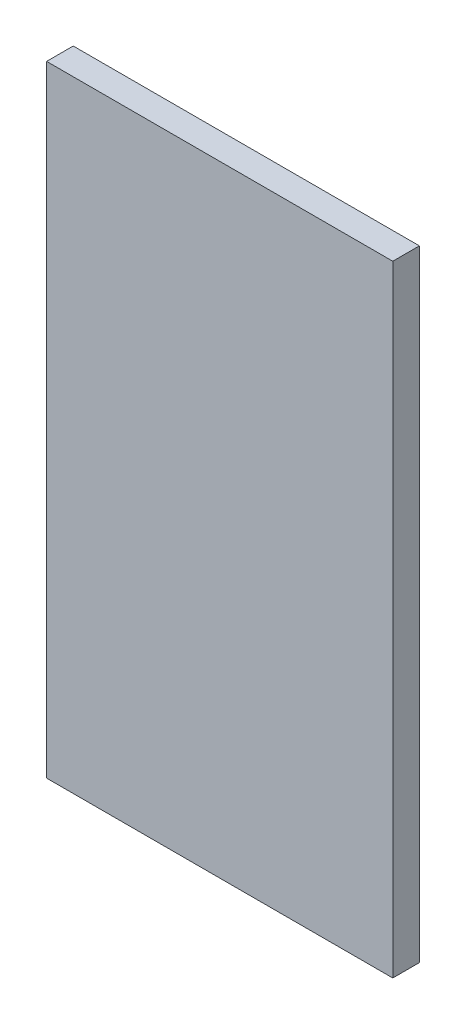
SolidWorks part; units mm, degrees
ref_plane "Спереди" through (0, 0, 0) normal (0, 0, 1) x (1, 0, 0)
ref_plane "Сверху" through (0, 0, 0) normal (0, 1, 0) x (1, 0, 0)
ref_plane "Справа" through (0, 0, 0) normal (1, 0, 0) x (0, 0, -1)
sketch "Эскиз1" plane through (0, 0, 0) normal (0, 0, 1) x (1, 0, 0)
  line L1 (0, 0) -> (208, 0)
  line L2 (0, 0) -> (0, -373)
  line L3 (0, -373) -> (208, -373)
  line L4 (208, 0) -> (208, -373)
  dimension "D1" = 208
  dimension "D2" = 373
extrude "Вытянуть1" add sketch "Эскиз1" along normal blind 16
